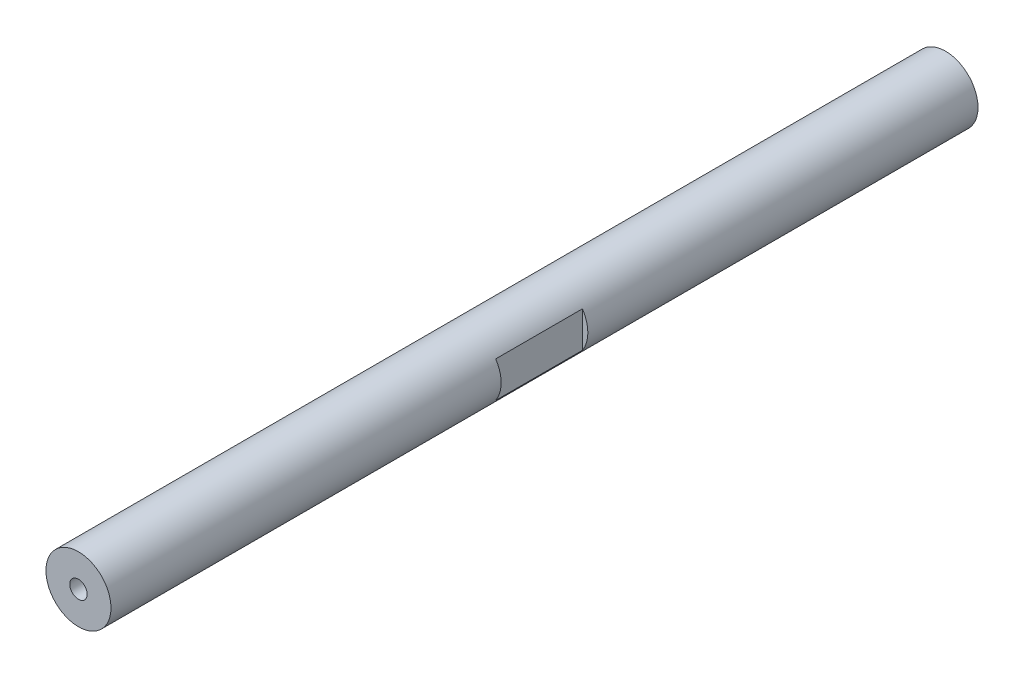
SolidWorks part; units mm, degrees
ref_plane "Front Plane" through (0, 0, 0) normal (0, 0, 1) x (1, 0, 0)
ref_plane "Top Plane" through (0, 0, 0) normal (0, 1, 0) x (1, 0, 0)
ref_plane "Right Plane" through (0, 0, 0) normal (1, 0, 0) x (0, 0, -1)
sketch "Sketch1" plane through (0, 0, 0) normal (0, 0, 1) x (1, 0, 0)
  circle A0 centre (0, 0) radius 9.525
  dimension "D1" = 19.05
extrude "Boss-Extrude1" add sketch "Sketch1" along normal mid plane 254
hole_wizard "1/4-20 Tapped Hole1" positions "Sketch2" profile "Sketch4" tap size "1/4-20" standard "ANSI Inch"
sketch "Sketch2" plane through (0, 0, 127) normal (0, 0, 1) x (1, 0, 0)
  point P0 (0, 0)
sketch "Sketch4" plane through (0, 0, 127) normal (1, 0, 0) x (0, -1, 0)
  line L0 (0, 0) -> (0, 33.2838)
  line L1 (0, 33.2838) -> (2.5527, 31.75)
  line L2 (2.5527, 31.75) -> (2.5527, 0)
  line L5 (2.5527, 0) -> (0, 0)
  line L10 (0, 33.2838) -> (-2.5527, 31.75) construction
  line L11 (0, -6.35) -> (0, 107.95) construction
  dimension "Tap Drill Dia." = 5.1054
  dimension "Tap Drill Depth" = 31.75
  dimension "Drill Angle" = 118
mirror "Mirror1" about plane through (0, 0, 0) normal (0, 0, 1) of "1/4-20 Tapped Hole1"
sketch "Sketch5" plane through (0, 0, 0) normal (0, 1, 0) x (1, 0, 0)
  line L0 (-9.525, -127) -> (9.525, -127) construction
  line L1 (9.525, 127) -> (-9.525, 127) construction
  line L2 (-9.525, -127) -> (9.525, -127) construction
  line L3 (9.525, 127) -> (-9.525, 127) construction
  line L4 (-9.525, -127) -> (-9.525, 127) construction
  line L5 (9.525, 127) -> (9.525, -127) construction
  line L11 (7.9375, -12.7) -> (-7.9375, -12.7) construction
  line L12 (7.9375, -12.7) -> (7.9375, 12.7) construction
  line L13 (7.9375, 12.7) -> (-7.9375, 12.7) construction
  line L14 (-7.9375, -12.7) -> (-7.9375, 12.7) construction
  line L15 (7.9375, -12.7) -> (-7.9375, 12.7) construction
  line L16 (7.9375, 12.7) -> (-7.9375, -12.7) construction
  line L17 (-7.9375, -12.7) -> (-9.525, -12.7)
  line L18 (-7.9375, -12.7) -> (-7.9375, 12.7)
  line L19 (-7.9375, 12.7) -> (-9.525, 12.7)
  line L20 (-9.525, -12.7) -> (-9.525, 12.7)
  line L21 (7.9375, -12.7) -> (9.525, -12.7)
  line L22 (7.9375, -12.7) -> (7.9375, 12.7)
  line L23 (7.9375, 12.7) -> (9.525, 12.7)
  line L24 (9.525, -12.7) -> (9.525, 12.7)
  point P4 (0, 0)
  dimension "D1" = 15.875
  dimension "D2" = 25.4
extrude "Cut-Extrude1" cut sketch "Sketch5" against normal through all both and the other way through all
